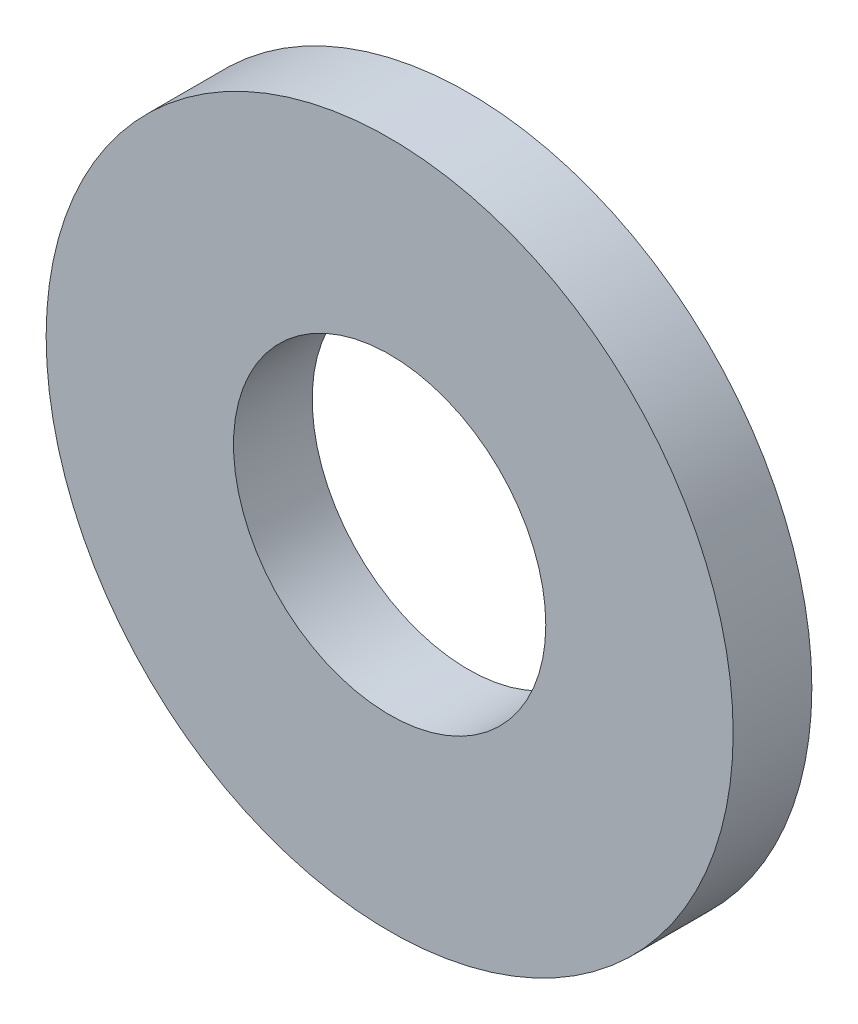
SolidWorks part; units mm, degrees
ref_plane "Plane1" through (0, 0, 0) normal (0, 0, 1) x (1, 0, 0)
ref_plane "Plane2" through (0, 0, 0) normal (0, 1, 0) x (1, 0, 0)
ref_plane "Plane3" through (0, 0, 0) normal (1, 0, 0) x (0, 0, -1)
sketch "Sketch1" plane through (0, 0, 0) normal (0, 0, 1) x (1, 0, 0)
  circle A0 centre (0, 0) radius 6.985
  dimension "D1" = 13.97
extrude "Base-Extrude" add sketch "Sketch1" along normal blind 1.6002
sketch "Sketch2" plane through (0, 0, 1.6002) normal (0, 0, 1) x (1, 0, 0)
  circle A0 centre (0, 0) radius 3.175
  dimension "D1" = 6.35
extrude "Cut-Extrude1" cut sketch "Sketch2" against normal through all
